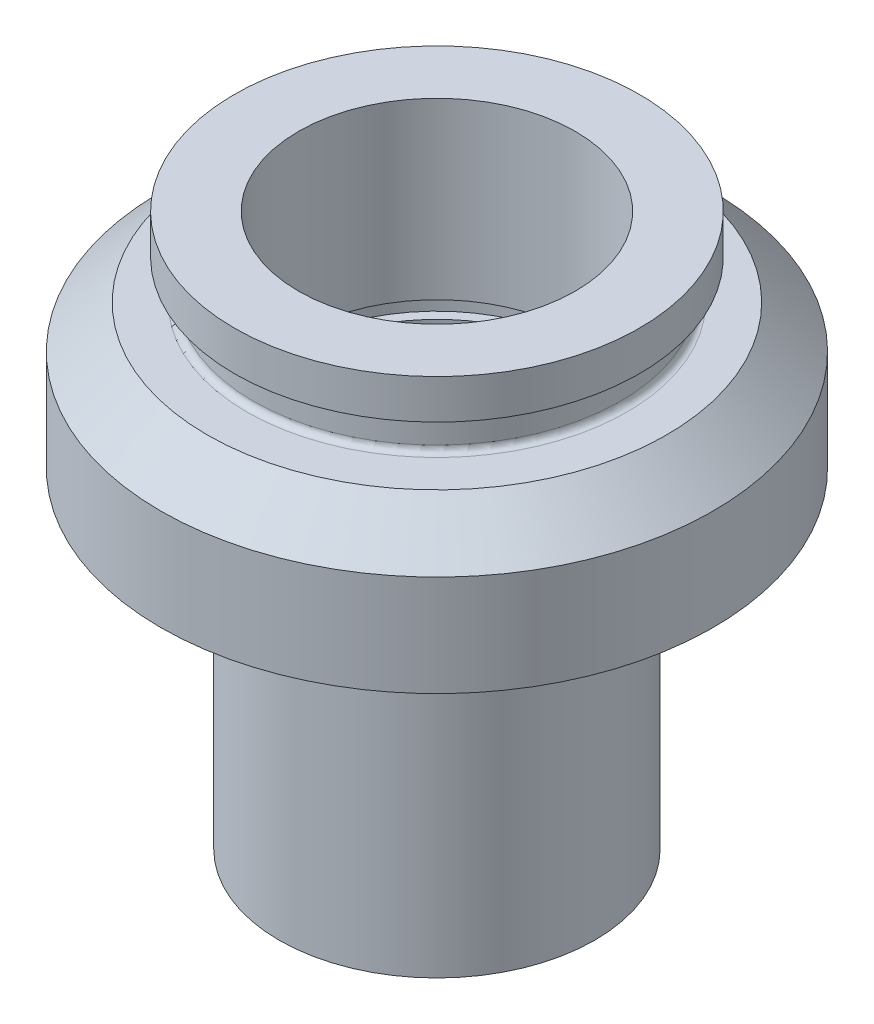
SolidWorks part; units mm, degrees
ref_plane "Front Plane" through (0, 0, 0) normal (0, 0, 1) x (1, 0, 0)
ref_plane "Top Plane" through (0, 0, 0) normal (0, 1, 0) x (1, 0, 0)
ref_plane "Right Plane" through (0, 0, 0) normal (1, 0, 0) x (0, 0, -1)
sketch "Sketch2" plane through (0, 0, 0) normal (1, 0, 0) x (0, 0, -1)
  line L0 (0, 21.7994) -> (0, -36.2585) construction
  line L1 (-8.7566, 0) -> (-8.7566, -25.4)
  line L2 (-12.7, -3.5179) -> (-12.7, -25.4)
  line L3 (-12.7, -25.4) -> (-8.7566, -25.4)
  line L4 (-12.7, -3.5179) -> (-11.4109, -3.5179)
  line L5 (-11.4109, -3.5179) -> (-11.4109, -0.254)
  line L6 (-11.6649, 0) -> (-14.9923, 0)
  line L7 (-14.9923, 0) -> (-14.9923, 2.2993)
  line L8 (-14.9923, 2.2993) -> (-18.8277, 2.2993)
  line L9 (-18.8277, 2.2993) -> (-18.8277, 0)
  line L10 (-18.8277, 0) -> (-20.212, 0)
  line L11 (-20.212, 0) -> (-20.212, 1.1497)
  line L12 (-20.212, 1.1497) -> (-22.225, 1.1497)
  line L13 (-22.225, 1.1497) -> (-22.225, 9.271)
  line L14 (-22.225, 9.271) -> (-18.4785, 12.7)
  line L15 (-18.4785, 12.7) -> (-15.2892, 12.7)
  line L16 (-14.7812, 13.208) -> (-14.7812, 15.367)
  line L17 (-15.2892, 15.875) -> (-16.2946, 15.875)
  line L18 (-16.2946, 15.875) -> (-16.2946, 19.05)
  line L19 (-16.2946, 19.05) -> (-11.1379, 19.05)
  line L20 (-11.1379, 19.05) -> (-11.1379, 5.011)
  line L21 (-11.1379, 5.011) -> (-11.938, 5.011)
  line L22 (-11.938, 5.011) -> (-11.938, 3.6479)
  line L23 (-11.938, 3.6479) -> (-11.1379, 3.6479)
  line L24 (-11.1379, 3.6479) -> (-11.1379, 2.2993)
  line L25 (-11.1379, 2.2993) -> (-8.7566, 2.2993)
  line L26 (-8.7566, 2.2993) -> (-8.7566, 0)
  arc A0 (-11.4109, -0.254) -> (-11.6649, 0) centre (-11.6649, -0.254) ccw
  arc A1 (-14.7812, 13.208) -> (-15.2892, 12.7) centre (-15.2892, 13.208) cw
  arc A2 (-14.7812, 15.367) -> (-15.2892, 15.875) centre (-15.2892, 15.367) ccw
  point P33 (-14.7812, 12.7)
  point P36 (-14.7812, 15.875)
  dimension "D6" = 0.254
  dimension "D14" = 0.508
  dimension "D1" = 17.5133
  dimension "D2" = 25.4
  dimension "D3" = 25.4
  dimension "D4" = 21.8821
  dimension "D5" = 22.8219
  dimension "D7" = 29.9847
  dimension "D8" = 37.6555
  dimension "D9" = 40.4241
  dimension "D10" = 44.45
  dimension "D11" = 22.2758
  dimension "D12" = 23.876
  dimension "D13" = 19.05
  dimension "D15" = 9.271
  dimension "D16" = 36.957
  dimension "D17" = 3.175
revolve "Revolve1" add sketch "Sketch2" angle 360 about L0
